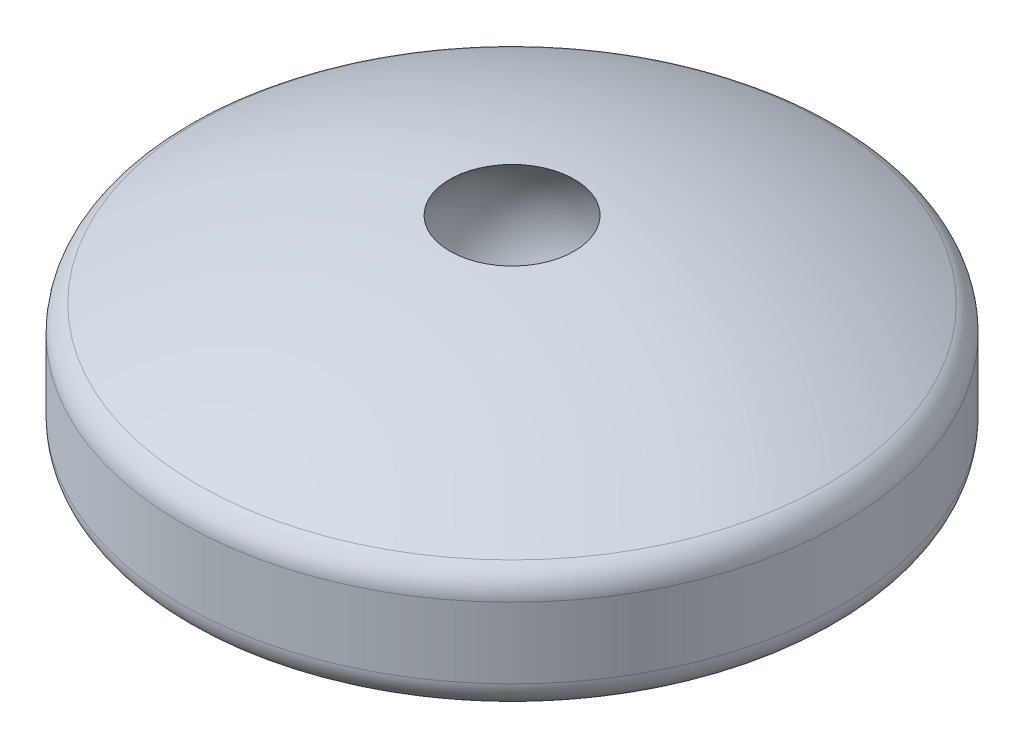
SolidWorks part; units mm, degrees
ref_plane "Front Plane" through (0, 0, 0) normal (0, 0, 1) x (1, 0, 0)
ref_plane "Top Plane" through (0, 0, 0) normal (0, 1, 0) x (1, 0, 0)
ref_plane "Right Plane" through (0, 0, 0) normal (1, 0, 0) x (0, 0, -1)
sketch "Sketch1" plane through (0, 0, 0) normal (0, 0, 1) x (1, 0, 0)
  line L0 (0, 0) -> (0, -48.6859) construction
  line L1 (0, 0) -> (-20.5, 0)
  line L2 (-22.5, 2) -> (-22.5, 6.8245)
  line L3 (0, 14) -> (58.6316, 14) construction
  line L4 (0, 14) -> (0, 0)
  arc A0 (0, 14) -> (-21.4493, 8.5848) centre (0, -31.1875) ccw
  arc A1 (-22.5, 6.8245) -> (-21.4493, 8.5848) centre (-20.5, 6.8245) cw
  arc A2 (-20.5, 0) -> (-22.5, 2) centre (-20.5, 2) cw
  point P10 (-22.5, 8)
  point P13 (-22.5, 0)
  dimension "D4" = 2
  dimension "D1" = 6
  dimension "D2" = 8
  dimension "D3" = 45
revolve "Revolve1" add sketch "Sketch1" angle 360 about L0
sketch "Sketch2" plane through (0, 0, 0) normal (1, 0, 0) x (0, 0, -1)
  line L0 (0, 8.8816) -> (0, 0) construction
  line L1 (-4.25, 13.7997) -> (4.25, 13.7997) construction
  line L2 (0, 15.3816) -> (0, 2.3816)
  line L3 (0, 15.3816) -> (0, 18.4659) construction
  arc A0 (0, 2.3816) -> (0, 15.3816) centre (0, 8.8816) ccw
  arc A1 (21.4493, 8.5848) -> (-21.4493, 8.5848) centre (0, -31.1875) ccw construction
  dimension "D1" = 13
  dimension "D2" = 8.5
revolve "Cut-Revolve1" cut sketch "Sketch2" angle 360 about L3
